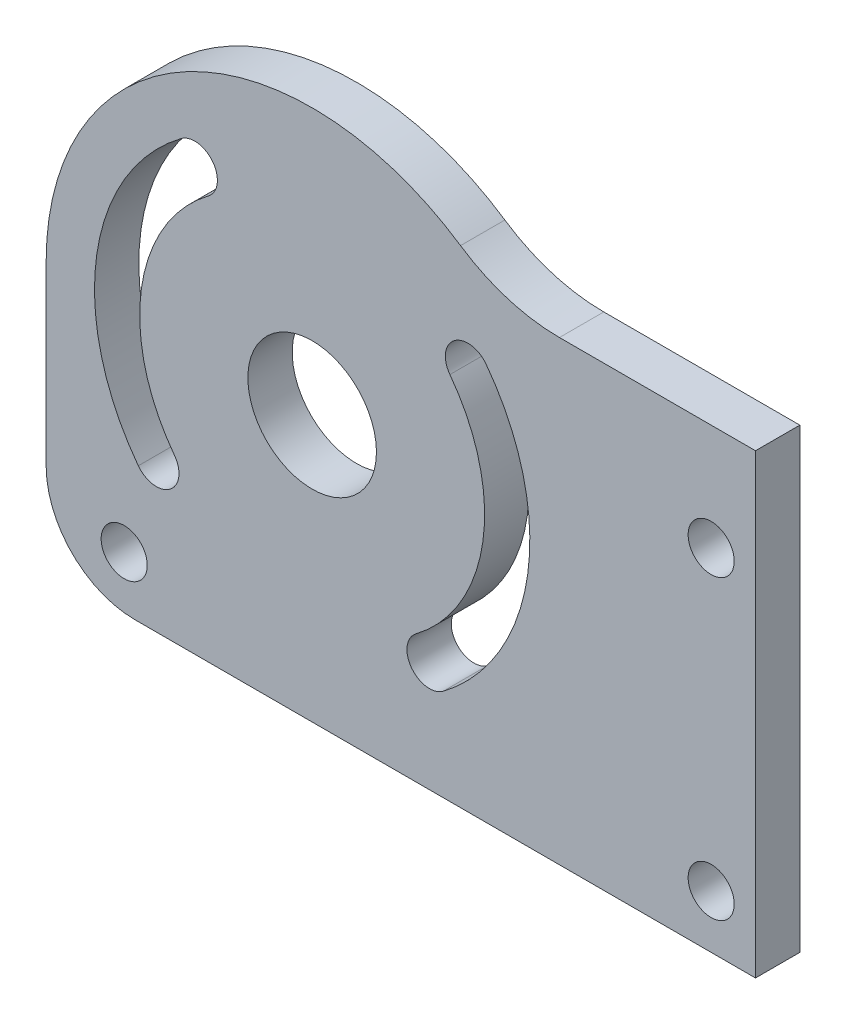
SolidWorks part; units mm, degrees
ref_plane "Plan de face" through (0, 0, 0) normal (0, 0, 1) x (1, 0, 0)
ref_plane "Plan de dessus" through (0, 0, 0) normal (0, 1, 0) x (1, 0, 0)
ref_plane "Plan de droite" through (0, 0, 0) normal (1, 0, 0) x (0, 0, -1)
sketch "Esquisse1" plane through (0, 0, 0) normal (0, 0, 1) x (1, 0, 0)
  line L0 (0, 95.1378) -> (0, -99.4994) construction
  line L1 (124.5787, 0) -> (-122.9431, 0) construction
  line L2 (40, 21.5) -> (17.8882, 21.5)
  line L3 (35, 41.5) -> (35, -33.4906) construction
  line L4 (-40, 0) -> (-40, -20)
  line L5 (-30, -30) -> (40, -30)
  line L6 (40, 21.5) -> (40, -30)
  line L7 (-54.9371, -24) -> (52.5356, -24) construction
  line L8 (-10, 32.4183) -> (-10, -28.3137) construction
  arc A0 (-40, -20) -> (-30, -30) centre (-30, -20) ccw
  arc A1 (6.7329, 24.9) -> (-40, 0) centre (-10, 0) ccw
  circle A2 centre (35, 9.5) radius 2.6
  arc A3 (6.7329, 24.9) -> (17.8882, 21.5) centre (17.8882, 41.5) ccw
  circle A4 centre (35, -24) radius 2.6
  circle A5 centre (-31.2, -24) radius 2.6
  dimension "D1" = 10
  dimension "D2" = 30
  dimension "D4" = 30
  dimension "D6" = 20
  dimension "D7" = 5.2
  dimension "D3" = 80
  dimension "D5" = 51.5
  dimension "D8" = 5
  dimension "D9" = 71.2
  dimension "D10" = 6
  dimension "D11" = 39.5
extrude "Extrusion1" add sketch "Esquisse1" along normal blind 5
sketch "Esquisse2" plane through (0, 0, 5) normal (0, 0, 1) x (1, 0, 0)
  line L0 (-10, 32.4355) -> (-10, -28.2726) construction
  line L1 (-42.062, 0) -> (7.7186, 0) construction
  line L2 (-30.624, 27.3689) -> (6.6837, -22.1401) construction
  line L3 (14.112, 18.1697) -> (-33.5685, -17.7601) construction
  line L4 (-10, 0) -> (24.5895, -4.8612) construction
  line L5 (-5.2147, 34.0491) -> (-14.0175, -28.586) construction
  circle A0 centre (-10, 0) radius 22 construction
  arc A1 (9.6065, 14.7746) -> (5.5335, 11.7053) centre (7.57, 13.2399) ccw
  arc A2 (1.7053, -15.5335) -> (4.7746, -19.6065) centre (3.2399, -17.57) ccw
  arc A3 (1.7053, -15.5335) -> (5.5335, 11.7053) centre (-10, 0) ccw
  circle A4 centre (-10, 0) radius 7.25
  arc A5 (4.7746, -19.6065) -> (9.6065, 14.7746) centre (-10, 0) ccw
  arc A6 (-25.5335, -11.7053) -> (-29.6065, -14.7746) centre (-27.57, -13.2399) cw
  arc A7 (-25.5335, -11.7053) -> (-21.7053, 15.5335) centre (-10, 0) cw
  arc A8 (-29.6065, -14.7746) -> (-24.7746, 19.6065) centre (-10, 0) cw
  arc A9 (-24.7746, 19.6065) -> (-21.7053, 15.5335) centre (-23.2399, 17.57) cw
  dimension "D1" = 44
  dimension "D4" = 19.45
  dimension "D5" = 14.5
  dimension "D2" = 37
  dimension "D3" = 53
  dimension "D6" = 45
extrude "Enlèv. mat.-Extru.1" cut sketch "Esquisse2" against normal through all
